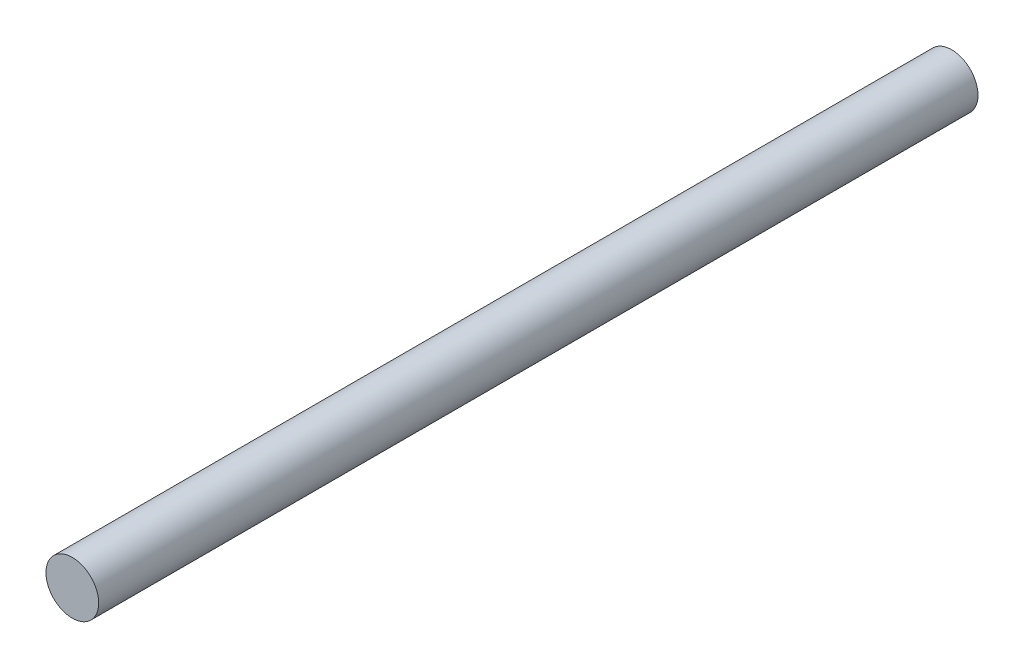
SolidWorks part; units mm, degrees
ref_plane "Front" through (0, 0, 0) normal (0, 0, 1) x (1, 0, 0)
ref_plane "Top" through (0, 0, 0) normal (0, 1, 0) x (1, 0, 0)
ref_plane "Right" through (0, 0, 0) normal (1, 0, 0) x (0, 0, -1)
sketch "Sketch1" plane through (0, 0, 0) normal (0, 0, 1) x (1, 0, 0)
  circle A0 centre (0, 0) radius 4
  dimension "D1" = 8
extrude "Boss-Extrude1" add sketch "Sketch1" along normal blind 133.4
